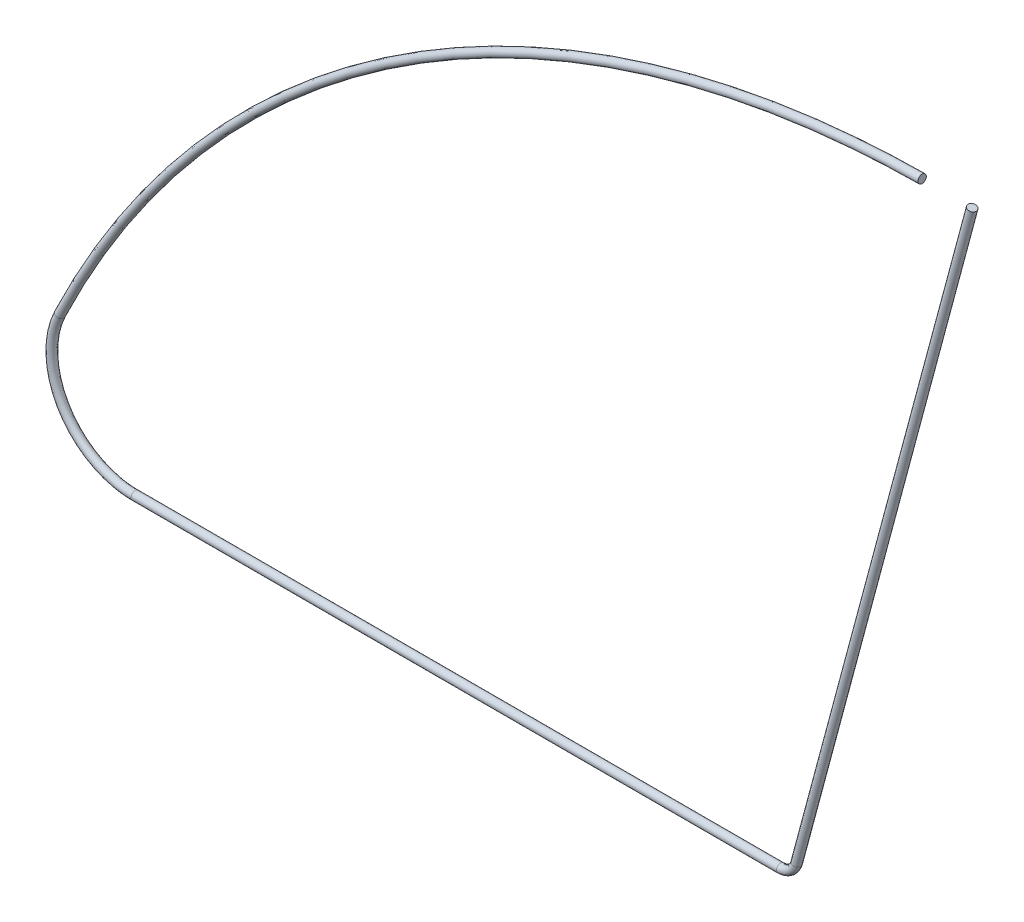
SolidWorks part; units mm, degrees
ref_plane "Plan1" through (0, 0, 0) normal (0, 0, 1) x (1, 0, 0)
ref_plane "Plan2" through (0, 0, 0) normal (0, 1, 0) x (1, 0, 0)
ref_plane "Plan3" through (0, 0, 0) normal (1, 0, 0) x (0, 0, -1)
sketch "Esquisse1" plane through (0, 0, 0) normal (0, 0, 1) x (1, 0, 0)
  line L1 (6, 0) -> (-15.0377, -78.5137)
  line L2 (-16.9695, -79.9961) -> (-94.3072, -79.9961)
  arc A0 (0, 0) -> (-103.3262, -65.6765) centre (0.9556, -115.6211) ccw
  arc A1 (-103.3262, -65.6765) -> (-94.3072, -79.9961) centre (-94.3072, -69.9961) ccw
  arc A2 (-15.0377, -78.5137) -> (-16.9695, -79.9961) centre (-16.9695, -77.9961) cw
  dimension "D2" = 105
  dimension "D3" = 10
  dimension "D1" = 2
  dimension "D5" = 115.625
  dimension "D4" = 6
  dimension "D6" = 79.9961
sketch "Esquisse2" plane through (0, 0, 0) normal (1, 0, 0) x (0, 0, -1)
  circle A0 centre (0, 0) radius 0.5
  dimension "D1" = 1
sweep "Balayage5" add profiles "Esquisse2" path "Esquisse1"
